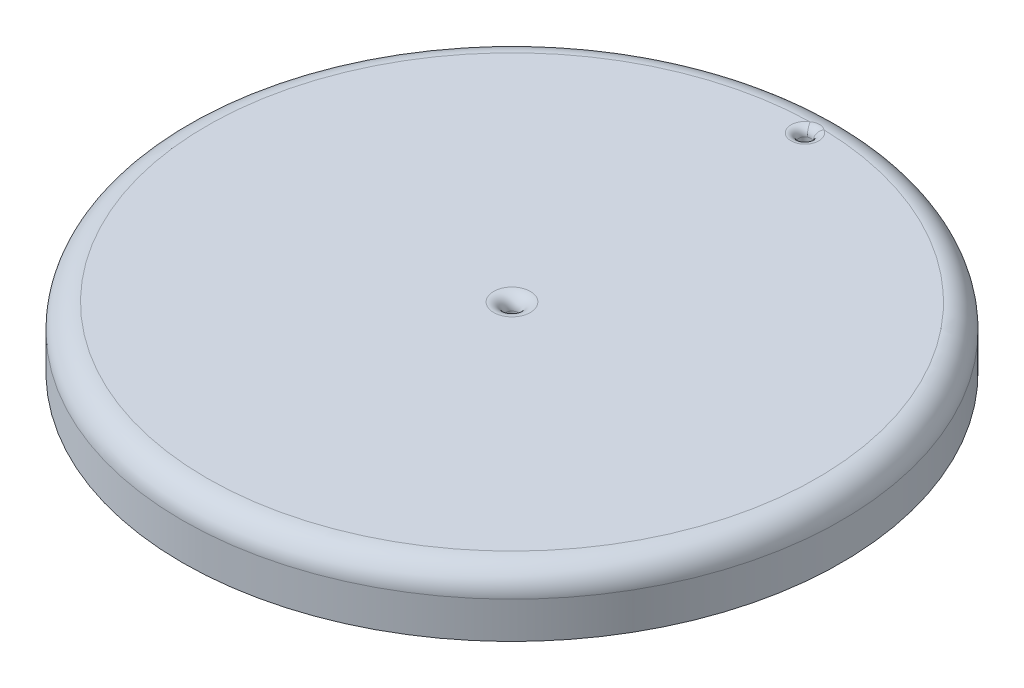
SolidWorks part; units mm, degrees
ref_plane "Front" through (0, 0, 0) normal (0, 0, 1) x (1, 0, 0)
ref_plane "Top" through (0, 0, 0) normal (0, 1, 0) x (1, 0, 0)
ref_plane "Right" through (0, 0, 0) normal (1, 0, 0) x (0, 0, -1)
sketch "Sketch3" plane through (0, 0, 0) normal (0, 1, 0) x (1, 0, 0)
  circle A0 centre (0, 0) radius 85.725
  circle A1 centre (0, 0) radius 1.5875
  circle A2 centre (0, 76.2) radius 1.5875
  dimension "D1" = 171.45
  dimension "D2" = 3.175
  dimension "D3" = 3.175
extrude "Base-Extrude" add sketch "Sketch3" along normal blind 15.875
fillet "Fillet2" radius 6.35 1 edges at (0, 15.875, 85.725)
fillet "Fillet3" radius 3.175 1 edges at (0, 15.875, 1.5875)
fillet "Fillet4" radius 2.032 1 edges at (0, 15.875, -74.6125)
